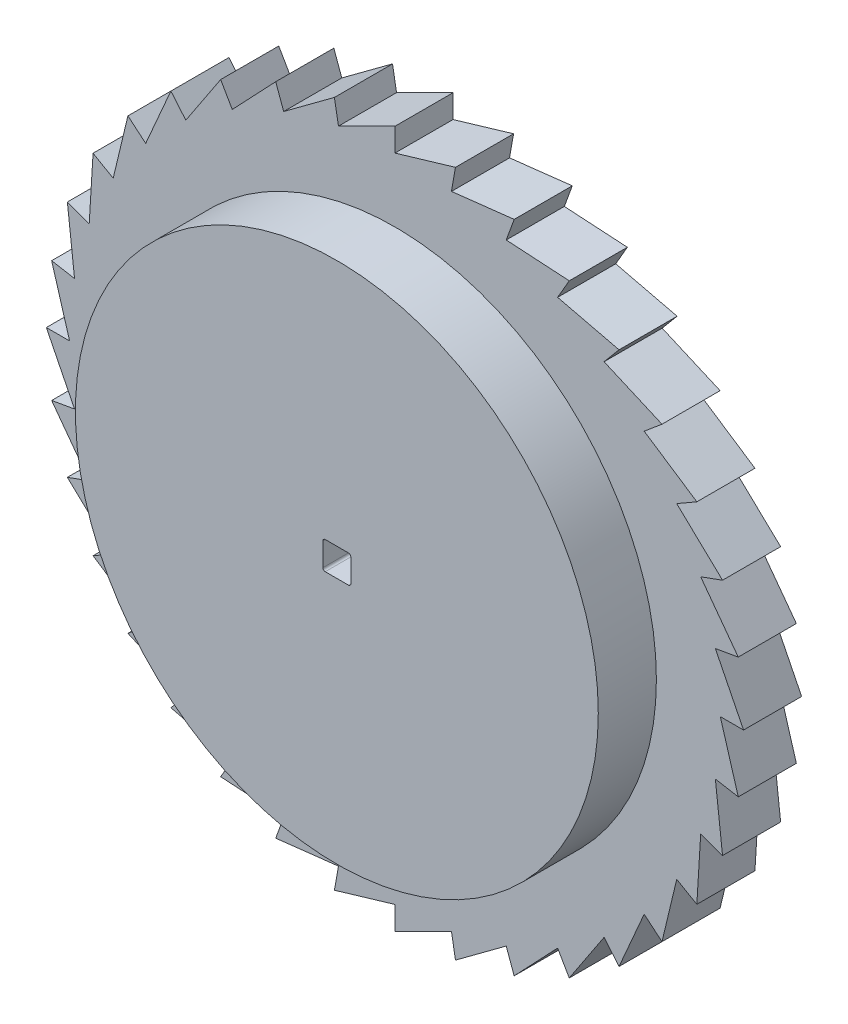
SolidWorks part; units mm, degrees
ref_plane "Front Plane" through (0, 0, 0) normal (0, 0, 1) x (1, 0, 0)
ref_plane "Top Plane" through (0, 0, 0) normal (0, 1, 0) x (1, 0, 0)
ref_plane "Right Plane" through (0, 0, 0) normal (1, 0, 0) x (0, 0, -1)
sketch "Sketch1" plane through (0, 0, 0) normal (0, 0, 1) x (1, 0, 0)
  line L0 (6.1749, 35.0198) -> (13.031, 35.8023)
  line L1 (6.1749, 35.0198) -> (6.616, 37.5212)
  line L2 (0, 35.56) -> (6.616, 37.5212)
  line L3 (12.1622, 33.4155) -> (13.031, 35.8023)
  line L4 (12.1622, 33.4155) -> (19.05, 32.9956)
  line L5 (17.78, 30.7959) -> (19.05, 32.9956)
  line L6 (17.78, 30.7959) -> (24.4902, 29.1863)
  line L7 (22.8575, 27.2405) -> (24.4902, 29.1863)
  line L8 (22.8575, 27.2405) -> (29.1863, 24.4902)
  line L9 (27.2405, 22.8575) -> (29.1863, 24.4902)
  line L10 (27.2405, 22.8575) -> (32.9956, 19.05)
  line L11 (30.7959, 17.78) -> (32.9956, 19.05)
  line L12 (30.7959, 17.78) -> (35.8023, 13.031)
  line L13 (33.4155, 12.1622) -> (35.8023, 13.031)
  line L14 (33.4155, 12.1622) -> (37.5212, 6.616)
  line L15 (35.0198, 6.1749) -> (37.5212, 6.616)
  line L16 (35.0198, 6.1749) -> (38.1, 0)
  line L17 (35.56, 0) -> (38.1, 0)
  line L18 (35.56, 0) -> (37.5212, -6.616)
  line L19 (35.0198, -6.1749) -> (37.5212, -6.616)
  line L20 (35.0198, -6.1749) -> (35.8023, -13.031)
  line L21 (33.4155, -12.1622) -> (35.8023, -13.031)
  line L22 (33.4155, -12.1622) -> (32.9956, -19.05)
  line L23 (30.7959, -17.78) -> (32.9956, -19.05)
  line L24 (30.7959, -17.78) -> (29.1863, -24.4902)
  line L25 (27.2405, -22.8575) -> (29.1863, -24.4902)
  line L26 (27.2405, -22.8575) -> (24.4902, -29.1863)
  line L27 (22.8575, -27.2405) -> (24.4902, -29.1863)
  line L28 (22.8575, -27.2405) -> (19.05, -32.9956)
  line L29 (17.78, -30.7959) -> (19.05, -32.9956)
  line L30 (17.78, -30.7959) -> (13.031, -35.8023)
  line L31 (12.1622, -33.4155) -> (13.031, -35.8023)
  line L32 (12.1622, -33.4155) -> (6.616, -37.5212)
  line L33 (6.1749, -35.0198) -> (6.616, -37.5212)
  line L34 (6.1749, -35.0198) -> (0, -38.1)
  line L35 (0, -35.56) -> (0, -38.1)
  line L36 (0, -35.56) -> (-6.616, -37.5212)
  line L37 (-6.1749, -35.0198) -> (-6.616, -37.5212)
  line L38 (-6.1749, -35.0198) -> (-13.031, -35.8023)
  line L39 (-12.1622, -33.4155) -> (-13.031, -35.8023)
  line L40 (-12.1622, -33.4155) -> (-19.05, -32.9956)
  line L41 (-17.78, -30.7959) -> (-19.05, -32.9956)
  line L42 (-17.78, -30.7959) -> (-24.4902, -29.1863)
  line L43 (-22.8575, -27.2405) -> (-24.4902, -29.1863)
  line L44 (-22.8575, -27.2405) -> (-29.1863, -24.4902)
  line L45 (-27.2405, -22.8575) -> (-29.1863, -24.4902)
  line L46 (-27.2405, -22.8575) -> (-32.9956, -19.05)
  line L47 (-30.7959, -17.78) -> (-32.9956, -19.05)
  line L48 (-30.7959, -17.78) -> (-35.8023, -13.031)
  line L49 (-33.4155, -12.1622) -> (-35.8023, -13.031)
  line L50 (-33.4155, -12.1622) -> (-37.5212, -6.616)
  line L51 (-35.0198, -6.1749) -> (-37.5212, -6.616)
  line L52 (-35.0198, -6.1749) -> (-38.1, 0)
  line L53 (-35.56, 0) -> (-38.1, 0)
  line L54 (-35.56, 0) -> (-37.5212, 6.616)
  line L55 (-35.0198, 6.1749) -> (-37.5212, 6.616)
  line L56 (-35.0198, 6.1749) -> (-35.8023, 13.031)
  line L57 (-33.4155, 12.1622) -> (-35.8023, 13.031)
  line L58 (-33.4155, 12.1622) -> (-32.9956, 19.05)
  line L59 (-30.7959, 17.78) -> (-32.9956, 19.05)
  line L60 (-30.7959, 17.78) -> (-29.1863, 24.4902)
  line L61 (-27.2405, 22.8575) -> (-29.1863, 24.4902)
  line L62 (-27.2405, 22.8575) -> (-24.4902, 29.1863)
  line L63 (-22.8575, 27.2405) -> (-24.4902, 29.1863)
  line L64 (-22.8575, 27.2405) -> (-19.05, 32.9956)
  line L65 (-17.78, 30.7959) -> (-19.05, 32.9956)
  line L66 (-17.78, 30.7959) -> (-13.031, 35.8023)
  line L67 (-12.1622, 33.4155) -> (-13.031, 35.8023)
  line L68 (-12.1622, 33.4155) -> (-6.616, 37.5212)
  line L69 (-6.1749, 35.0198) -> (-6.616, 37.5212)
  line L70 (-6.1749, 35.0198) -> (0, 38.1)
  line L71 (0, 35.56) -> (0, 38.1)
  point P113 (0, 0)
  dimension "D1" = 36
extrude "Boss-Extrude1" add sketch "Sketch1" along normal blind 6.35
sketch "Sketch2" plane through (0, 0, 6.35) normal (0, 0, 1) x (1, 0, 0)
  circle A0 centre (0, 0) radius 28.575
extrude "Boss-Extrude2" add sketch "Sketch2" along normal blind 6.35
sketch "Sketch3" plane through (0, 0, 0) normal (0, 0, -1) x (-1, 0, 0)
  line L1 (-1.524, 1.524) -> (1.524, 1.524)
  line L2 (-1.524, 1.524) -> (-1.524, -1.524)
  line L3 (-1.524, -1.524) -> (1.524, -1.524)
  line L4 (1.524, 1.524) -> (1.524, -1.524)
  line L5 (-1.524, 1.524) -> (1.524, -1.524) construction
  line L6 (-1.524, -1.524) -> (1.524, 1.524) construction
  point P0 (0, 0)
  dimension "D1" = 3.048
  dimension "D2" = 3.048
extrude "Cut-Extrude1" cut sketch "Sketch3" against normal through all
fillet "Fillet1" radius 0.254 4 edges at (1.524, -1.524, 6.35) (-1.524, -1.524, 6.35) (-1.524, 1.524, 6.35) (1.524, 1.524, 6.35)
